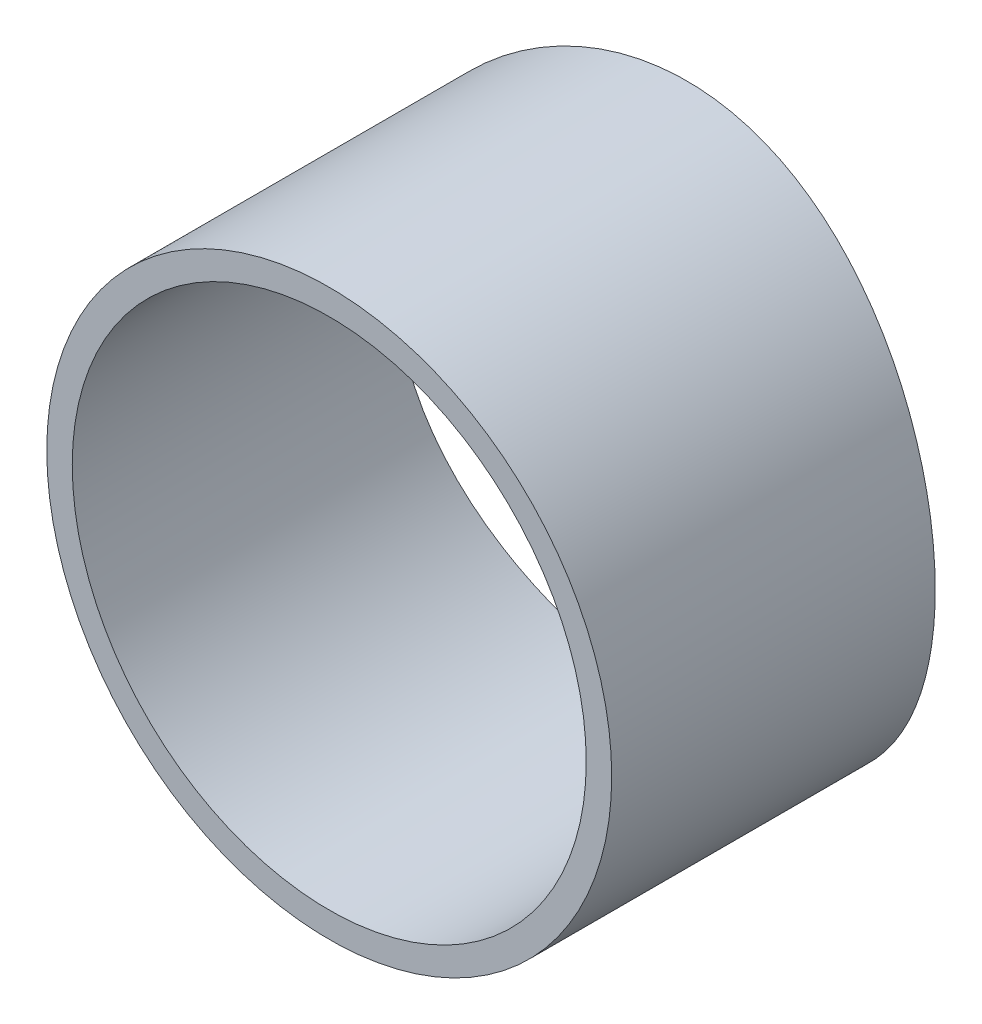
SolidWorks part; units mm, degrees
ref_plane "Plan de face" through (0, 0, 0) normal (0, 0, 1) x (1, 0, 0)
ref_plane "Plan de dessus" through (0, 0, 0) normal (0, 1, 0) x (1, 0, 0)
ref_plane "Plan de droite" through (0, 0, 0) normal (1, 0, 0) x (0, 0, -1)
sketch "Esquisse1" plane through (0, 0, 0) normal (0, 0, 1) x (1, 0, 0)
  circle A0 centre (400, 0) radius 69.85
  dimension "D1" = 139.7
  dimension "D2" = 400
extrude "Extru.-Mince1" add sketch "Esquisse1" against normal up to surface (670 mm away) thin
sketch "Esquisse2" plane through (0, 0, 0) normal (1, 0, 0) x (0, 0, -1)
  circle A1 centre (375, 0) radius 295 construction
  circle A2 centre (375, 0) radius 295
extrude "Enlèv. mat.-Extru.3" cut sketch "Esquisse2" along normal blind 540
